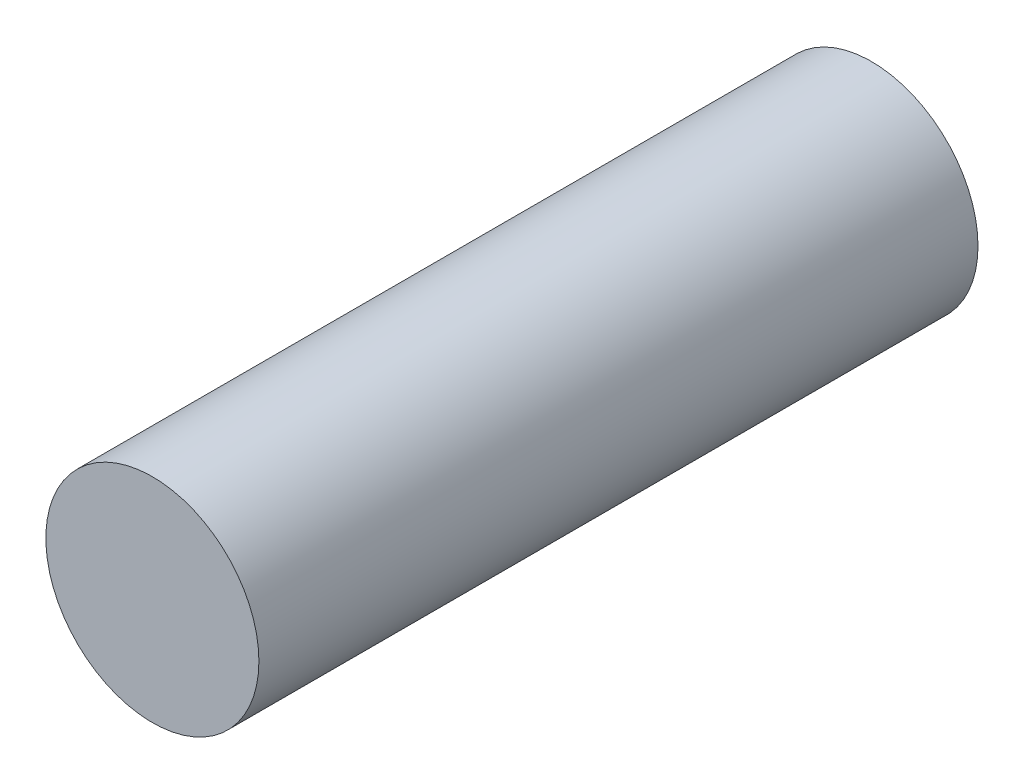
SolidWorks part; units mm, degrees
ref_plane "前视基准面" through (0, 0, 0) normal (0, 0, 1) x (1, 0, 0)
ref_plane "上视基准面" through (0, 0, 0) normal (0, 1, 0) x (1, 0, 0)
ref_plane "右视基准面" through (0, 0, 0) normal (1, 0, 0) x (0, 0, -1)
other "Configuration Table"
sketch "草图1" plane through (0, 0, 0) normal (0, 0, 1) x (1, 0, 0)
  circle A0 centre (0, 0) radius 2
  dimension "D1" = 4
extrude "Mounting_Screw_Shank_D4" add sketch "草图1" against normal mid plane 13.5
